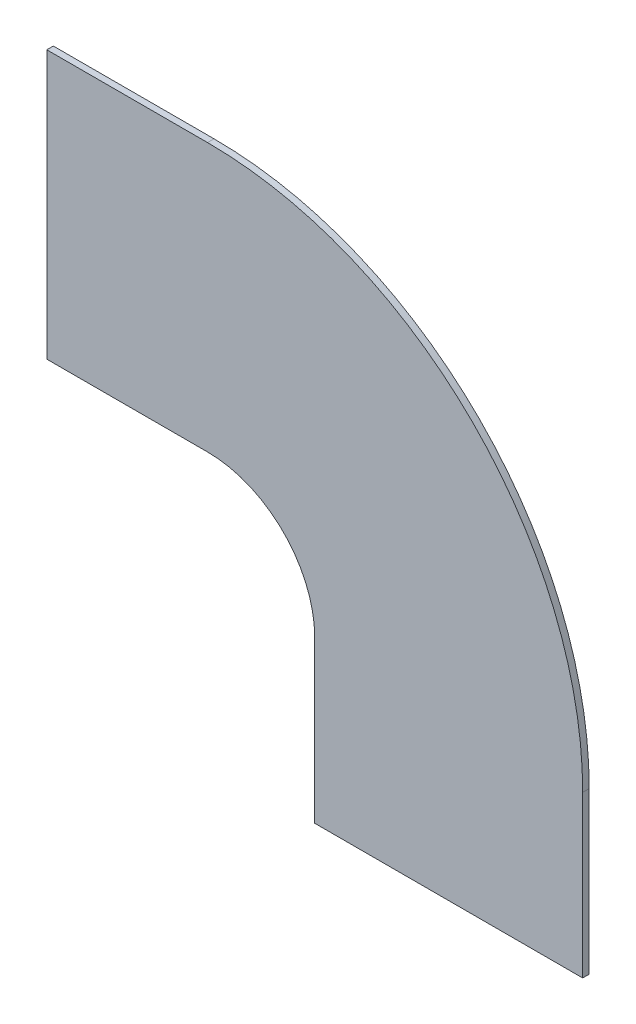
SolidWorks part; units mm, degrees
ref_plane "Front Plane" through (0, 0, 0) normal (0, 0, 1) x (1, 0, 0)
ref_plane "Top Plane" through (0, 0, 0) normal (0, 1, 0) x (1, 0, 0)
ref_plane "Right Plane" through (0, 0, 0) normal (1, 0, 0) x (0, 0, -1)
sketch "Sketch1" plane through (0, 0, 0) normal (0, 0, 1) x (1, 0, 0)
  line L0 (0, 0) -> (0, -50)
  line L1 (0, -50) -> (30, -50)
  line L2 (50, -70) -> (50, -100)
  line L3 (50, -100) -> (100, -100)
  line L4 (100, -100) -> (100, -70)
  line L5 (30, 0) -> (0, 0)
  arc A0 (30, -50) -> (50, -70) centre (30, -70) cw
  arc A1 (100, -70) -> (30, 0) centre (30, -70) ccw
  dimension "D1" = 30
  dimension "D2" = 50
  dimension "D3" = 100
sheet metal parameters "Sheet-Metal1" thickness 1.2141 parameters "D1"=1.27
base flange "Base-Flange1" sketch "Sketch1" thickness 1.2141 reverse thickness direction yes parameters "D1"=1.27
flat pattern "Flat-Pattern1"
sketch "Bend-Lines1" [suppressed] plane through (0, 0, 0) normal (0, 1, 0) x (-1, 0, 0)
